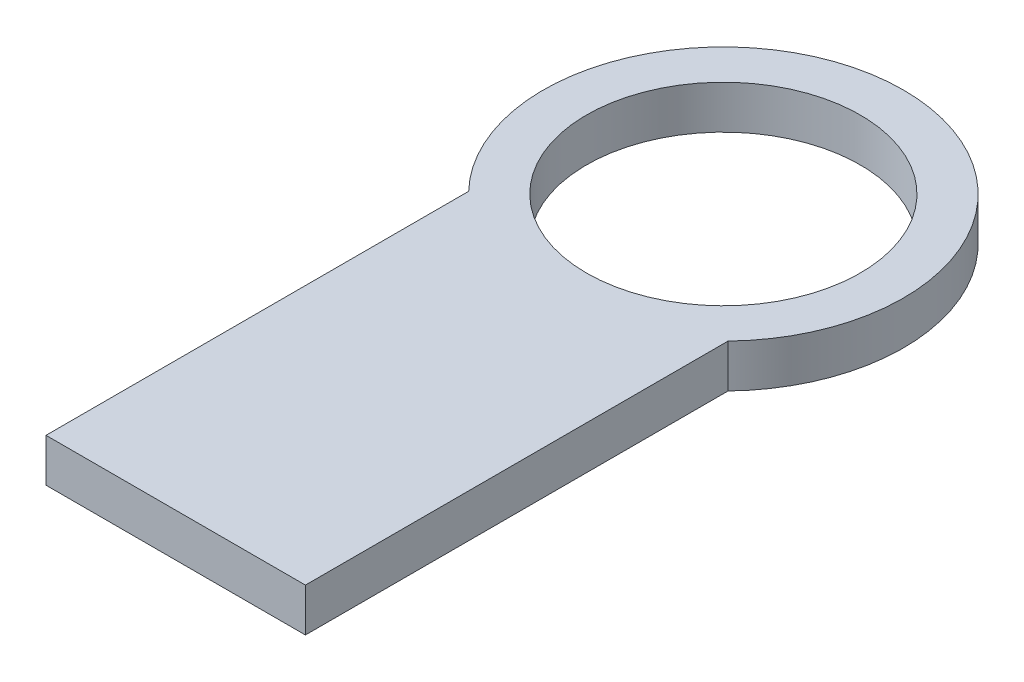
SolidWorks part; units mm, degrees
ref_plane "Front" through (0, 0, 0) normal (0, 0, 1) x (1, 0, 0)
ref_plane "Top" through (0, 0, 0) normal (0, 1, 0) x (1, 0, 0)
ref_plane "Right" through (0, 0, 0) normal (1, 0, 0) x (0, 0, -1)
sketch "Sketch1" plane through (0, 0, 0) normal (0, 1, 0) x (1, 0, 0)
  line L1 (9, 0) -> (9, 29.3253)
  line L2 (-9, 0) -> (-9, 29.3253)
  line L3 (-9, 0) -> (9, 0)
  circle A0 centre (0, 38) radius 9.5
  arc A1 (9, 29.3253) -> (-9, 29.3253) centre (0, 38) ccw
  dimension "D1" = 18
  dimension "D3" = 12.5
  dimension "D4" = 19
  dimension "D2" = 38
extrude "Extrude1" add sketch "Sketch1" along normal blind 3
